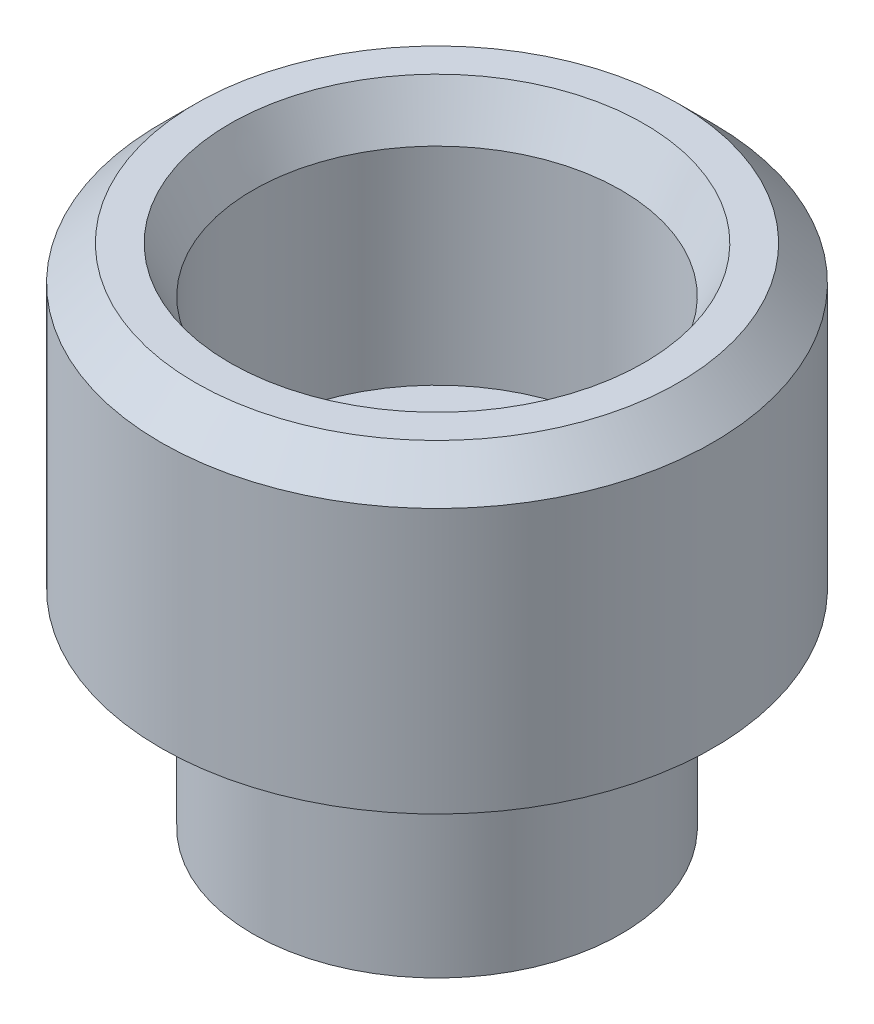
SolidWorks part; units mm, degrees
ref_plane "Přední rovina" through (0, 0, 0) normal (0, 0, 1) x (1, 0, 0)
ref_plane "Horní rovina" through (0, 0, 0) normal (0, 1, 0) x (1, 0, 0)
ref_plane "Pravá rovina" through (0, 0, 0) normal (1, 0, 0) x (0, 0, -1)
sketch "Skica1" plane through (0, 0, 0) normal (0, 1, 0) x (1, 0, 0)
  circle A0 centre (0, 0) radius 8
extrude "Přidat vysunutím1" add sketch "Skica1" along normal blind 9
sketch "Skica2" plane through (0, 9, 0) normal (0, 1, 0) x (-1, 0, 0)
  circle A0 centre (0, 0) radius 12
extrude "Přidat vysunutím2" add sketch "Skica2" along normal blind 13
chamfer "Zkosení1" distance 2.5 distance2 4 1 edges at (0, 9, 8)
chamfer "Zkosení2" distance 1.5 angle 45 1 edges at (0, 22, 12)
sketch "Skica3" plane through (0, 0, 0) normal (0, -1, 0) x (1, 0, 0)
  circle A0 centre (0, 0) radius 3.5
extrude "Odebrat vysunutím1" cut sketch "Skica3" against normal blind 11
sketch "Skica4" plane through (0, 22, 0) normal (0, 1, 0) x (-1, 0, 0)
  circle A0 centre (0, 0) radius 8
extrude "Odebrat vysunutím2" cut sketch "Skica4" against normal blind 11
chamfer "Zkosení3" distance 1 distance2 2 1 edges at (0, 22, 8)
